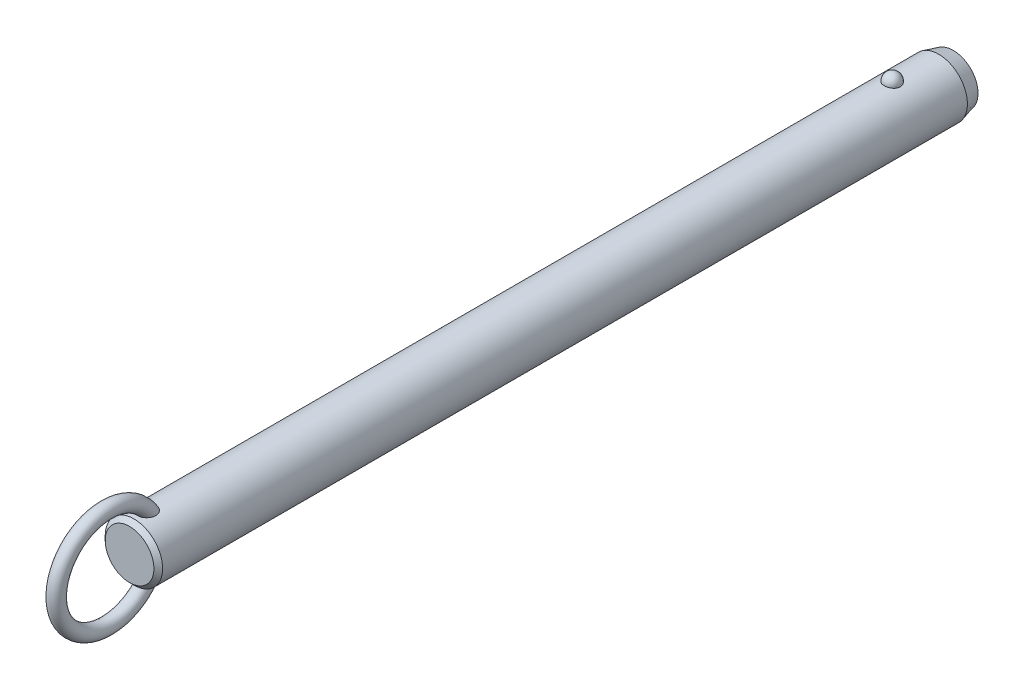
SolidWorks part; units mm, degrees
ref_plane "Front Plane" through (0, 0, 0) normal (0, 0, 1) x (1, 0, 0)
ref_plane "Top Plane" through (0, 0, 0) normal (0, 1, 0) x (1, 0, 0)
ref_plane "Right Plane" through (0, 0, 0) normal (1, 0, 0) x (0, 0, -1)
sketch "Sketch2" plane through (0, 0, 0) normal (0, 0, 1) x (1, 0, 0)
  circle A0 centre (0, 0) radius 7.9
  point P3 (0, 7.9)
  dimension "D1" = 15.8
extrude "Boss-Extrude1" add sketch "Sketch2" along normal blind 198.1
sketch "Sketch3" plane through (0, 0, 0) normal (0, 0, -1) x (-1, 0, 0)
  circle A0 centre (0, 0) radius 7.9
  dimension "D1" = 15.8
extrude "Boss-Extrude2" add sketch "Sketch3" along normal blind 19
chamfer "Chamfer1" distance 4 angle 15 1 edges at (-7.9, 0, -19)
sketch "Sketch12" plane through (0, 0, 0) normal (1, 0, 0) x (0, 0, -1)
  line L0 (-198.1, 7.9) -> (-198.1, -7.9) construction
  point P0 (-198.1, 0)
sketch "Sketch13" plane through (0, 0, 0) normal (1, 0, 0) x (0, 0, -1)
  circle A0 centre (-213.95, 0) radius 15.85
  point P2 (-198.1, 0)
  dimension "D1" = 31.7
sketch "Sketch14" plane through (0, 0, 0) normal (0, 1, 0) x (1, 0, 0)
  circle A0 centre (0, -200.1) radius 2
  point P2 (0, -198.1)
  dimension "D1" = 4
sweep "Sweep1" add profiles "Sketch14" path "Sketch13"
sketch "Sketch15" plane through (0, 0, 198.1) normal (0, 0, 1) x (1, 0, 0)
  circle A0 centre (0, 0) radius 7.9
  dimension "D1" = 15.8
extrude "Boss-Extrude3" add sketch "Sketch15" along normal blind 9.52
chamfer "Chamfer2" distance 1.2 angle 45 1 edges at (7.9, 0, 207.62)
sketch "Sketch18" plane through (0, 0, 0) normal (1, 0, 0) x (0, 0, -1)
  line L0 (15, 7.9) -> (-200.2091, 7.9) construction
  line L1 (2.2, 10.1) -> (2.2, 5.7)
  line L2 (-200.2091, -7.9) -> (15, -7.9) construction
  arc A0 (2.2, 10.1) -> (2.2, 5.7) centre (2.2, 7.9) ccw
  point P4 (0, 7.9)
  dimension "D1" = 18
revolve "Revolve1" add sketch "Sketch18" angle 360 about L1
